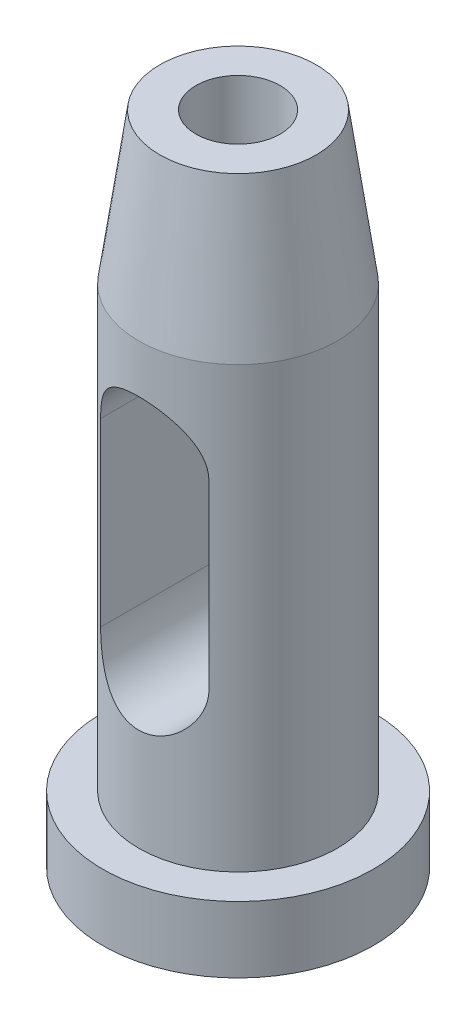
SolidWorks part; units mm, degrees
ref_plane "Front Plane" through (0, 0, 0) normal (0, 0, 1) x (1, 0, 0)
ref_plane "Top Plane" through (0, 0, 0) normal (0, 1, 0) x (1, 0, 0)
ref_plane "Right Plane" through (0, 0, 0) normal (1, 0, 0) x (0, 0, -1)
sketch "Sketch1" plane through (0, 0, 0) normal (0, 1, 0) x (1, 0, 0)
  circle A0 centre (0, 0) radius 22.5
  dimension "D1" = 45
extrude "Boss-Extrude1" add sketch "Sketch1" along normal blind 84
sketch "Sketch2" plane through (0, 84, 0) normal (0, 1, 0) x (1, 0, 0)
  circle A0 centre (0, 0) radius 22.5
  circle A1 centre (0, 0) radius 16.5
  dimension "D1" = 45
  dimension "D2" = 33
extrude "Cut-Extrude1" cut sketch "Sketch2" against normal blind 73
sketch "Sketch3" plane through (0, 0, 0) normal (0, 0, 1) x (1, 0, 0)
  line L0 (0, 37) -> (0, 67) construction
  line L1 (-9, 37) -> (-9, 67)
  line L2 (9, 37) -> (9, 67)
  arc A0 (-9, 37) -> (9, 37) centre (0, 37) ccw
  arc A1 (9, 67) -> (-9, 67) centre (0, 67) ccw
  point P3 (0, 52)
  dimension "D1" = 9
  dimension "D2" = 30
  dimension "D3" = 37
extrude "Cut-Extrude2" cut sketch "Sketch3" against normal mid plane 98
sketch "Sketch4" plane through (0, 84, 0) normal (0, 1, 0) x (1, 0, 0)
  circle A0 centre (0, 0) radius 16.5
  dimension "D1" = 33
extrude "Boss-Extrude2" add sketch "Sketch4" along normal blind 25 draft 8
hole_wizard "Tap Drill for M16x2.0 Tap1" positions "Sketch5" profile "Sketch6" hole size "M16x2.0" standard "ANSI Metric"
sketch "Sketch5" plane through (0, 109, 0) normal (0, 1, 0) x (1, 0, 0)
  point P0 (0, 0)
sketch "Sketch6" plane through (0, 109, 0) normal (1, 0, 0) x (0, 0, 1)
  line L0 (0, 0) -> (0, 29.206)
  line L1 (0, 29.206) -> (7, 25)
  line L2 (7, 25) -> (7, 0)
  line L5 (7, 0) -> (0, 0)
  line L10 (0, 29.206) -> (-7, 25) construction
  line L11 (0, -6.35) -> (0, 107.95) construction
  dimension "Hole Dia." = 14
  dimension "Hole Depth" = 25
  dimension "Drill Angle" = 118
